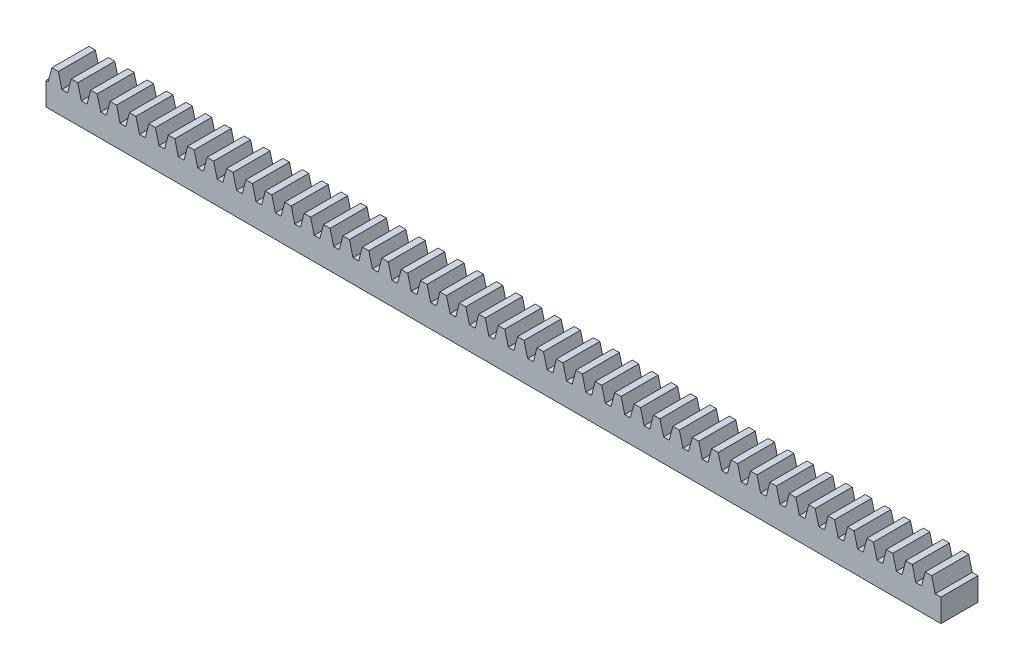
SolidWorks part; units mm, degrees
ref_plane "Front" through (0, 0, 0) normal (0, 0, 1) x (1, 0, 0)
ref_plane "Top" through (0, 0, 0) normal (0, 1, 0) x (1, 0, 0)
ref_plane "Right" through (0, 0, 0) normal (1, 0, 0) x (0, 0, -1)
sketch "Sketch1" plane through (0, 0, 0) normal (0, 0, 1) x (1, 0, 0)
  line L0 (0, 0) -> (153.3246, 0)
  line L1 (153.3246, 3.9446) -> (153.3246, 0)
  line L2 (9.375, 3.9446) -> (10.3556, 3.9446)
  line L3 (19.3496, 3.9446) -> (20.3302, 3.9446)
  line L4 (13.6804, 3.9446) -> (14.2959, 6.3246)
  line L5 (16.0248, 3.9446) -> (15.4093, 6.3246)
  line L6 (10.9711, 6.3246) -> (12.0844, 6.3246)
  line L7 (12.6999, 3.9446) -> (12.0844, 6.3246)
  line L8 (12.6999, 3.9446) -> (13.6804, 3.9446)
  line L9 (17.0053, 3.9446) -> (17.6208, 6.3246)
  line L10 (0, 3.9446) -> (0.381, 3.9446)
  line L11 (3.7059, 3.9446) -> (4.3214, 6.3246)
  line L12 (6.0502, 3.9446) -> (5.4347, 6.3246)
  line L13 (0, 3.9446) -> (0, 0)
  line L14 (0.9965, 6.3246) -> (2.1098, 6.3246)
  line L15 (2.7253, 3.9446) -> (2.1098, 6.3246)
  line L16 (14.2959, 6.3246) -> (15.4093, 6.3246)
  line L17 (2.7253, 3.9446) -> (3.7059, 3.9446)
  line L18 (7.0307, 3.9446) -> (7.6462, 6.3246)
  line L19 (4.3214, 6.3246) -> (5.4347, 6.3246)
  line L20 (9.375, 3.9446) -> (8.7595, 6.3246)
  line L21 (19.3496, 3.9446) -> (18.7341, 6.3246)
  line L22 (16.0248, 3.9446) -> (17.0053, 3.9446)
  line L23 (6.0502, 3.9446) -> (7.0307, 3.9446)
  line L24 (7.6462, 6.3246) -> (8.7595, 6.3246)
  line L25 (17.6208, 6.3246) -> (18.7341, 6.3246)
  line L26 (10.3556, 3.9446) -> (10.9711, 6.3246)
  line L27 (29.3242, 3.9446) -> (30.3047, 3.9446)
  line L28 (0.381, 3.9446) -> (0.9965, 6.3246)
  line L29 (23.655, 3.9446) -> (24.2705, 6.3246)
  line L30 (25.9993, 3.9446) -> (25.3838, 6.3246)
  line L31 (20.9457, 6.3246) -> (22.059, 6.3246)
  line L32 (22.6745, 3.9446) -> (22.059, 6.3246)
  line L33 (22.6745, 3.9446) -> (23.655, 3.9446)
  line L34 (26.9799, 3.9446) -> (27.5954, 6.3246)
  line L35 (24.2705, 6.3246) -> (25.3838, 6.3246)
  line L36 (29.3242, 3.9446) -> (28.7087, 6.3246)
  line L37 (25.9993, 3.9446) -> (26.9799, 3.9446)
  line L38 (27.5954, 6.3246) -> (28.7087, 6.3246)
  line L39 (20.3302, 3.9446) -> (20.9457, 6.3246)
  line L40 (39.2988, 3.9446) -> (40.2793, 3.9446)
  line L41 (33.6296, 3.9446) -> (34.2451, 6.3246)
  line L42 (35.9739, 3.9446) -> (35.3584, 6.3246)
  line L43 (30.9202, 6.3246) -> (32.0336, 6.3246)
  line L44 (32.6491, 3.9446) -> (32.0336, 6.3246)
  line L45 (32.6491, 3.9446) -> (33.6296, 3.9446)
  line L46 (36.9545, 3.9446) -> (37.57, 6.3246)
  line L47 (34.2451, 6.3246) -> (35.3584, 6.3246)
  line L48 (39.2988, 3.9446) -> (38.6833, 6.3246)
  line L49 (35.9739, 3.9446) -> (36.9545, 3.9446)
  line L50 (37.57, 6.3246) -> (38.6833, 6.3246)
  line L51 (30.3047, 3.9446) -> (30.9202, 6.3246)
  line L52 (49.2734, 3.9446) -> (50.2539, 3.9446)
  line L53 (43.6042, 3.9446) -> (44.2197, 6.3246)
  line L54 (45.9485, 3.9446) -> (45.333, 6.3246)
  line L55 (40.8948, 6.3246) -> (42.0081, 6.3246)
  line L56 (42.6236, 3.9446) -> (42.0081, 6.3246)
  line L57 (42.6236, 3.9446) -> (43.6042, 3.9446)
  line L58 (46.929, 3.9446) -> (47.5445, 6.3246)
  line L59 (44.2197, 6.3246) -> (45.333, 6.3246)
  line L60 (49.2734, 3.9446) -> (48.6579, 6.3246)
  line L61 (45.9485, 3.9446) -> (46.929, 3.9446)
  line L62 (47.5445, 6.3246) -> (48.6579, 6.3246)
  line L63 (40.2793, 3.9446) -> (40.8948, 6.3246)
  line L64 (59.2479, 3.9446) -> (60.2285, 3.9446)
  line L65 (53.5788, 3.9446) -> (54.1943, 6.3246)
  line L66 (55.9231, 3.9446) -> (55.3076, 6.3246)
  line L67 (50.8694, 6.3246) -> (51.9827, 6.3246)
  line L68 (52.5982, 3.9446) -> (51.9827, 6.3246)
  line L69 (52.5982, 3.9446) -> (53.5788, 3.9446)
  line L70 (56.9036, 3.9446) -> (57.5191, 6.3246)
  line L71 (54.1943, 6.3246) -> (55.3076, 6.3246)
  line L72 (59.2479, 3.9446) -> (58.6324, 6.3246)
  line L73 (55.9231, 3.9446) -> (56.9036, 3.9446)
  line L74 (57.5191, 6.3246) -> (58.6324, 6.3246)
  line L75 (50.2539, 3.9446) -> (50.8694, 6.3246)
  line L76 (69.2225, 3.9446) -> (70.2031, 3.9446)
  line L77 (63.5533, 3.9446) -> (64.1688, 6.3246)
  line L78 (65.8977, 3.9446) -> (65.2822, 6.3246)
  line L79 (60.844, 6.3246) -> (61.9573, 6.3246)
  line L80 (62.5728, 3.9446) -> (61.9573, 6.3246)
  line L81 (62.5728, 3.9446) -> (63.5533, 3.9446)
  line L82 (66.8782, 3.9446) -> (67.4937, 6.3246)
  line L83 (64.1688, 6.3246) -> (65.2822, 6.3246)
  line L84 (69.2225, 3.9446) -> (68.607, 6.3246)
  line L85 (65.8977, 3.9446) -> (66.8782, 3.9446)
  line L86 (67.4937, 6.3246) -> (68.607, 6.3246)
  line L87 (60.2285, 3.9446) -> (60.844, 6.3246)
  line L88 (79.1971, 3.9446) -> (80.1776, 3.9446)
  line L89 (73.5279, 3.9446) -> (74.1434, 6.3246)
  line L90 (75.8722, 3.9446) -> (75.2567, 6.3246)
  line L91 (70.8186, 6.3246) -> (71.9319, 6.3246)
  line L92 (72.5474, 3.9446) -> (71.9319, 6.3246)
  line L93 (72.5474, 3.9446) -> (73.5279, 3.9446)
  line L94 (76.8528, 3.9446) -> (77.4683, 6.3246)
  line L95 (74.1434, 6.3246) -> (75.2567, 6.3246)
  line L96 (79.1971, 3.9446) -> (78.5816, 6.3246)
  line L97 (75.8722, 3.9446) -> (76.8528, 3.9446)
  line L98 (77.4683, 6.3246) -> (78.5816, 6.3246)
  line L99 (70.2031, 3.9446) -> (70.8186, 6.3246)
  line L100 (89.1717, 3.9446) -> (90.1522, 3.9446)
  line L101 (83.5025, 3.9446) -> (84.118, 6.3246)
  line L102 (85.8468, 3.9446) -> (85.2313, 6.3246)
  line L103 (80.7931, 6.3246) -> (81.9065, 6.3246)
  line L104 (82.522, 3.9446) -> (81.9065, 6.3246)
  line L105 (82.522, 3.9446) -> (83.5025, 3.9446)
  line L106 (86.8274, 3.9446) -> (87.4429, 6.3246)
  line L107 (84.118, 6.3246) -> (85.2313, 6.3246)
  line L108 (89.1717, 3.9446) -> (88.5562, 6.3246)
  line L109 (85.8468, 3.9446) -> (86.8274, 3.9446)
  line L110 (87.4429, 6.3246) -> (88.5562, 6.3246)
  line L111 (80.1776, 3.9446) -> (80.7931, 6.3246)
  line L112 (99.1463, 3.9446) -> (100.1268, 3.9446)
  line L113 (93.4771, 3.9446) -> (94.0926, 6.3246)
  line L114 (95.8214, 3.9446) -> (95.2059, 6.3246)
  line L115 (90.7677, 6.3246) -> (91.881, 6.3246)
  line L116 (92.4965, 3.9446) -> (91.881, 6.3246)
  line L117 (92.4965, 3.9446) -> (93.4771, 3.9446)
  line L118 (96.8019, 3.9446) -> (97.4174, 6.3246)
  line L119 (94.0926, 6.3246) -> (95.2059, 6.3246)
  line L120 (99.1463, 3.9446) -> (98.5308, 6.3246)
  line L121 (95.8214, 3.9446) -> (96.8019, 3.9446)
  line L122 (97.4174, 6.3246) -> (98.5308, 6.3246)
  line L123 (90.1522, 3.9446) -> (90.7677, 6.3246)
  line L124 (109.1208, 3.9446) -> (110.1014, 3.9446)
  line L125 (103.4517, 3.9446) -> (104.0672, 6.3246)
  line L126 (105.796, 3.9446) -> (105.1805, 6.3246)
  line L127 (100.7423, 6.3246) -> (101.8556, 6.3246)
  line L128 (102.4711, 3.9446) -> (101.8556, 6.3246)
  line L129 (102.4711, 3.9446) -> (103.4517, 3.9446)
  line L130 (106.7765, 3.9446) -> (107.392, 6.3246)
  line L131 (104.0672, 6.3246) -> (105.1805, 6.3246)
  line L132 (109.1208, 3.9446) -> (108.5053, 6.3246)
  line L133 (105.796, 3.9446) -> (106.7765, 3.9446)
  line L134 (107.392, 6.3246) -> (108.5053, 6.3246)
  line L135 (100.1268, 3.9446) -> (100.7423, 6.3246)
  line L136 (119.0954, 3.9446) -> (120.076, 3.9446)
  line L137 (113.4262, 3.9446) -> (114.0417, 6.3246)
  line L138 (115.7706, 3.9446) -> (115.1551, 6.3246)
  line L139 (110.7169, 6.3246) -> (111.8302, 6.3246)
  line L140 (112.4457, 3.9446) -> (111.8302, 6.3246)
  line L141 (112.4457, 3.9446) -> (113.4262, 3.9446)
  line L142 (116.7511, 3.9446) -> (117.3666, 6.3246)
  line L143 (114.0417, 6.3246) -> (115.1551, 6.3246)
  line L144 (119.0954, 3.9446) -> (118.4799, 6.3246)
  line L145 (115.7706, 3.9446) -> (116.7511, 3.9446)
  line L146 (117.3666, 6.3246) -> (118.4799, 6.3246)
  line L147 (110.1014, 3.9446) -> (110.7169, 6.3246)
  line L148 (129.07, 3.9446) -> (130.0505, 3.9446)
  line L149 (123.4008, 3.9446) -> (124.0163, 6.3246)
  line L150 (125.7451, 3.9446) -> (125.1296, 6.3246)
  line L151 (120.6915, 6.3246) -> (121.8048, 6.3246)
  line L152 (122.4203, 3.9446) -> (121.8048, 6.3246)
  line L153 (122.4203, 3.9446) -> (123.4008, 3.9446)
  line L154 (126.7257, 3.9446) -> (127.3412, 6.3246)
  line L155 (124.0163, 6.3246) -> (125.1296, 6.3246)
  line L156 (129.07, 3.9446) -> (128.4545, 6.3246)
  line L157 (125.7451, 3.9446) -> (126.7257, 3.9446)
  line L158 (127.3412, 6.3246) -> (128.4545, 6.3246)
  line L159 (120.076, 3.9446) -> (120.6915, 6.3246)
  line L160 (139.0446, 3.9446) -> (140.0251, 3.9446)
  line L161 (133.3754, 3.9446) -> (133.9909, 6.3246)
  line L162 (135.7197, 3.9446) -> (135.1042, 6.3246)
  line L163 (130.666, 6.3246) -> (131.7794, 6.3246)
  line L164 (132.3949, 3.9446) -> (131.7794, 6.3246)
  line L165 (132.3949, 3.9446) -> (133.3754, 3.9446)
  line L166 (136.7003, 3.9446) -> (137.3158, 6.3246)
  line L167 (133.9909, 6.3246) -> (135.1042, 6.3246)
  line L168 (139.0446, 3.9446) -> (138.4291, 6.3246)
  line L169 (135.7197, 3.9446) -> (136.7003, 3.9446)
  line L170 (137.3158, 6.3246) -> (138.4291, 6.3246)
  line L171 (130.0505, 3.9446) -> (130.666, 6.3246)
  line L172 (149.0192, 3.9446) -> (149.9997, 3.9446)
  line L173 (143.35, 3.9446) -> (143.9655, 6.3246)
  line L174 (145.6943, 3.9446) -> (145.0788, 6.3246)
  line L175 (140.6406, 6.3246) -> (141.7539, 6.3246)
  line L176 (142.3694, 3.9446) -> (141.7539, 6.3246)
  line L177 (142.3694, 3.9446) -> (143.35, 3.9446)
  line L178 (146.6748, 3.9446) -> (147.2903, 6.3246)
  line L179 (143.9655, 6.3246) -> (145.0788, 6.3246)
  line L180 (149.0192, 3.9446) -> (148.4037, 6.3246)
  line L181 (145.6943, 3.9446) -> (146.6748, 3.9446)
  line L182 (147.2903, 6.3246) -> (148.4037, 6.3246)
  line L183 (140.0251, 3.9446) -> (140.6406, 6.3246)
  line L184 (153.3246, 3.9446) -> (153.9401, 6.3246)
  line L185 (155.6689, 3.9446) -> (155.0534, 6.3246)
  line L186 (156.6494, 3.9446) -> (157.2649, 6.3246)
  line L187 (150.6152, 6.3246) -> (151.7285, 6.3246)
  line L188 (152.344, 3.9446) -> (151.7285, 6.3246)
  line L189 (152.344, 3.9446) -> (153.3246, 3.9446)
  line L190 (153.9401, 6.3246) -> (155.0534, 6.3246)
  line L191 (158.9937, 3.9446) -> (158.3782, 6.3246)
  line L192 (155.6689, 3.9446) -> (156.6494, 3.9446)
  line L193 (157.2649, 6.3246) -> (158.3782, 6.3246)
  line L194 (9.375, 3.9446) -> (10.3555, 3.9446)
  line L195 (149.9997, 3.9446) -> (150.6152, 6.3246)
  line L196 (158.9937, 3.9446) -> (159.9742, 3.9446)
  line L197 (19.3496, 3.9446) -> (20.3301, 3.9446)
  line L198 (29.3242, 3.9446) -> (30.3046, 3.9446)
  line L199 (39.2988, 3.9446) -> (40.2792, 3.9446)
  line L200 (49.2734, 3.9446) -> (50.2538, 3.9446)
  line L201 (59.2479, 3.9446) -> (60.2284, 3.9446)
  line L202 (69.2225, 3.9446) -> (70.203, 3.9446)
  line L203 (79.1971, 3.9446) -> (80.1775, 3.9446)
  line L204 (89.1717, 3.9446) -> (90.1521, 3.9446)
  line L205 (99.1463, 3.9446) -> (100.1267, 3.9446)
  line L206 (109.1208, 3.9446) -> (110.1013, 3.9446)
  line L207 (119.0954, 3.9446) -> (120.0759, 3.9446)
  line L208 (129.07, 3.9446) -> (130.0504, 3.9446)
  line L209 (139.0446, 3.9446) -> (140.025, 3.9446)
  line L210 (149.0192, 3.9446) -> (149.9996, 3.9446)
extrude "Base-Extrude" add sketch "Sketch1" against normal blind 6.35
